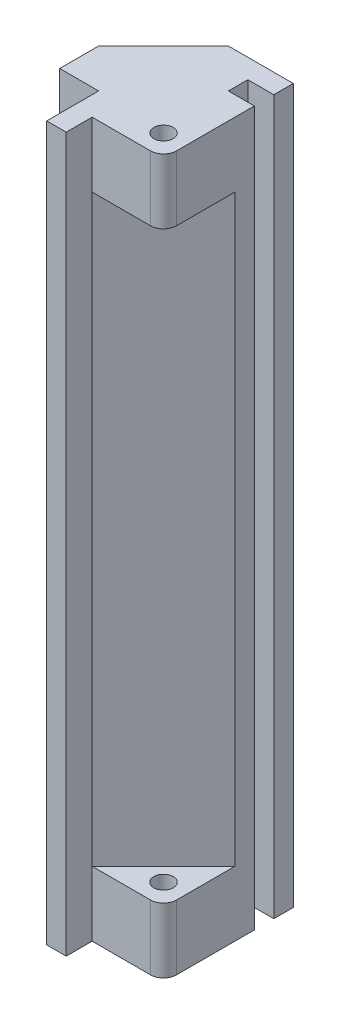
SolidWorks part; units mm, degrees
ref_plane "Front Plane" through (0, 0, 0) normal (0, 0, 1) x (1, 0, 0)
ref_plane "Top Plane" through (0, 0, 0) normal (0, 1, 0) x (1, 0, 0)
ref_plane "Right Plane" through (0, 0, 0) normal (1, 0, 0) x (0, 0, -1)
sketch "Sketch1" plane through (0, 0, 0) normal (0, 1, 0) x (1, 0, 0)
  line L6 (-5, 10) -> (5, 10) construction
  line L7 (5, 10) -> (5, 20) construction
  line L8 (-5, 10) -> (5, 20)
  line L18 (5, 20) -> (15, 20)
  line L19 (15, 20) -> (15, 17)
  line L20 (15, 17) -> (11, 17)
  line L21 (11, 17) -> (11, 14)
  line L22 (11, 14) -> (15, 14)
  line L23 (15, 14) -> (15, 11)
  line L24 (-5, 10) -> (-5, 0)
  line L25 (-5, 0) -> (-2, 0)
  line L26 (-2, 0) -> (-2, 4)
  line L27 (-2, 4) -> (1, 4)
  line L28 (1, 4) -> (1, 0)
  line L29 (1, 0) -> (4, 0)
  line L30 (15, 11) -> (4, 0)
extrude "Boss-Extrude1" add sketch "Sketch1" along normal blind 110
sketch "Sketch2" plane through (-2, 0, 0) normal (1, 0, 0) x (0, 0, -1)
  line L0 (4, 0) -> (4, 110)
  line L1 (4, 110) -> (0, 110)
  line L2 (0, 110) -> (0, 0)
  line L3 (0, 0) -> (4, 0)
extrude "Cut-Extrude1" cut sketch "Sketch2" against normal blind 10
sketch "Sketch3" plane through (0, 0, 0) normal (0, 0, 1) x (1, 0, 0)
  line L0 (4, 0) -> (4, 110)
  line L1 (4, 110) -> (1, 110)
  line L2 (1, 110) -> (1, 0)
  line L3 (1, 0) -> (4, 0)
extrude "Boss-Extrude2" add sketch "Sketch3" along normal blind 4
sketch "Sketch4" plane through (0, 0, 0) normal (0, -1, 0) x (1, 0, 0)
  line L0 (15, -11) -> (15, 0) construction
  line L1 (15, 0) -> (4, 0) construction
  line L2 (4, 0) -> (15, 0)
  line L3 (15, 0) -> (15, -11)
  line L4 (15, -11) -> (4, 0)
  line L5 (9.5, -5.5) -> (11.6213, -3.3787) construction
  circle A0 centre (11.6213, -3.3787) radius 1.5
extrude "Boss-Extrude3" add sketch "Sketch4" against normal blind 10
sketch "Sketch5" plane through (0, 110, 0) normal (0, 1, 0) x (1, 0, 0)
  line L0 (15, 11) -> (15, 0)
  line L1 (15, 0) -> (4, 0)
  line L2 (4, 0) -> (15, 11)
  line L3 (9.5, 5.5) -> (11.6213, 3.3787) construction
  circle A0 centre (11.6213, 3.3787) radius 1.5
extrude "Boss-Extrude4" add sketch "Sketch5" against normal blind 10
fillet "Fillet1" radius 2 2 edges at (15, 5, 0) (15, 105, 0)
